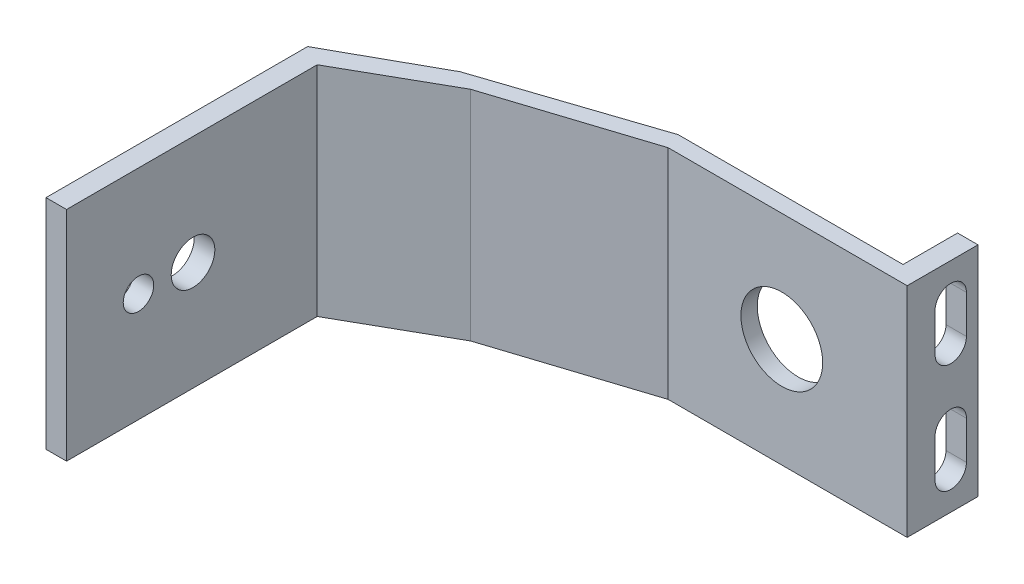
SolidWorks part; units mm, degrees
ref_plane "Front Plane" through (0, 0, 0) normal (0, 0, 1) x (1, 0, 0)
ref_plane "Top Plane" through (0, 0, 0) normal (0, 1, 0) x (1, 0, 0)
ref_plane "Right Plane" through (0, 0, 0) normal (1, 0, 0) x (0, 0, -1)
sketch "Sketch1" plane through (0, 0, 0) normal (0, 1, 0) x (1, 0, 0)
  line L0 (0, 0) -> (0, 30.48)
  line L1 (30.48, 43.18) -> (56.6737, 43.18)
  line L2 (59.055, 49.53) -> (56.6737, 49.53)
  line L3 (59.055, 41.2779) -> (31.2033, 41.2779)
  line L4 (0, 0) -> (2.394, 0)
  line L5 (11.43, 36.83) -> (30.48, 43.18)
  line L6 (11.43, 36.83) -> (0, 30.48)
  line L7 (2.394, 0) -> (2.394, 29.2027)
  line L8 (2.394, 29.2027) -> (13.8036, 35.6682)
  line L9 (13.8036, 35.6682) -> (31.2033, 41.2779)
  line L10 (59.055, 43.18) -> (59.055, 49.53)
  line L11 (59.055, 43.18) -> (59.055, 41.2779)
  line L12 (56.6737, 49.53) -> (56.6737, 43.18)
  dimension "D1" = 30.48
  dimension "D2" = 6.35
  dimension "D3" = 6.35
  dimension "D4" = 11.43
  dimension "D5" = 19.05
  dimension "D6" = 6.35
  dimension "D7" = 59.055
extrude "Extrude1" add sketch "Sketch1" along normal blind 25.4
sketch "Sketch2" plane through (0, 0, -43.18) normal (0, 0, -1) x (-1, 0, 0)
  circle A0 centre (-92.075, 12.7) radius 4.7625
  circle A1 centre (-44.45, 12.7) radius 4.7625
extrude "Cut-Extrude1" cut sketch "Sketch2" against normal blind 25.4
sketch "Sketch3" plane through (56.6737, 0, 0) normal (-1, 0, 0) x (0, 0, 1)
  line L0 (-49.53, 25.4) -> (-43.18, 25.4) construction
  line L3 (-43.18, 25.4) -> (-43.18, 0) construction
  line L5 (-48.1838, 16.8275) -> (-48.1838, 21.2725)
  line L6 (-44.5262, 16.8275) -> (-44.5262, 21.2725)
  line L9 (-48.1838, 4.1275) -> (-48.1838, 8.5725)
  line L10 (-44.5262, 4.1275) -> (-44.5262, 8.5725)
  arc A0 (-44.5262, 21.2725) -> (-48.1838, 21.2725) centre (-46.355, 21.2725) ccw
  arc A1 (-48.1838, 16.8275) -> (-44.5262, 16.8275) centre (-46.355, 16.8275) ccw
  arc A2 (-44.5262, 8.5725) -> (-48.1838, 8.5725) centre (-46.355, 8.5725) ccw
  arc A3 (-48.1838, 4.1275) -> (-44.5262, 4.1275) centre (-46.355, 4.1275) ccw
  dimension "D1" = 4.1275
  dimension "D3" = 3.175
  dimension "D4" = 1.8288
  dimension "D5" = 1.8288
  dimension "D6" = 12.7
  dimension "D2" = 4.445
  dimension "D7" = 12.7
extrude "Cut-Extrude2" cut sketch "Sketch3" against normal through all
sketch "Sketch4" plane through (0, 0, 0) normal (-1, 0, 0) x (0, 0, 1)
  line L0 (0, 25.4) -> (0, 0) construction
  circle A0 centre (-8.382, 12.7) radius 1.778
  circle A1 centre (-14.732, 12.7) radius 2.54
  dimension "D2" = 14.732
  dimension "D1" = 8.382
extrude "Cut-Extrude3" cut sketch "Sketch4" against normal through all
